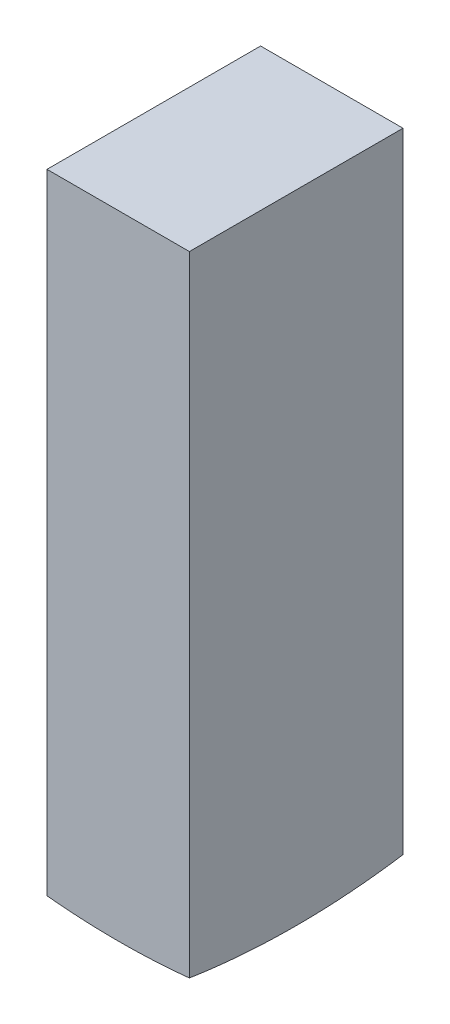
SolidWorks part; units mm, degrees
ref_plane "Plan de face" through (0, 0, 0) normal (0, 0, 1) x (1, 0, 0)
ref_plane "Plan de dessus" through (0, 0, 0) normal (0, 1, 0) x (1, 0, 0)
ref_plane "Plan de droite" through (0, 0, 0) normal (1, 0, 0) x (0, 0, -1)
sketch "Esquisse1" plane through (0, 0, 0) normal (0, 0, 1) x (1, 0, 0)
  line L1 (-2, 0) -> (2, 0)
  line L2 (-2, 0) -> (-2, 18)
  line L3 (-2, 18) -> (2, 18)
  line L4 (2, 0) -> (2, 18)
  point P5 (0, 0)
  dimension "D1" = 18
  dimension "D2" = 4
extrude "Extrusion1" add sketch "Esquisse1" along normal mid plane 6
sketch "Esquisse2" plane through (0, 0, 0) normal (0, 0, 1) x (1, 0, 0)
  line L0 (0, -3.5006) -> (0, 27.9733) construction
  line L1 (-4.0552, 0.4154) -> (-4.0552, -1.0014)
  line L4 (-2, 0) -> (2, 0) construction
  line L5 (-4.0552, -1.0014) -> (0, -1.0014)
  line L6 (0, -1.0014) -> (0, 0)
  arc A0 (-4.0552, 0.4154) -> (0, 0) centre (0, 20) ccw
  dimension "D1" = 20
revolve "Enlèvement de matière-Révolution3" cut sketch "Esquisse2" angle 360 about L6
